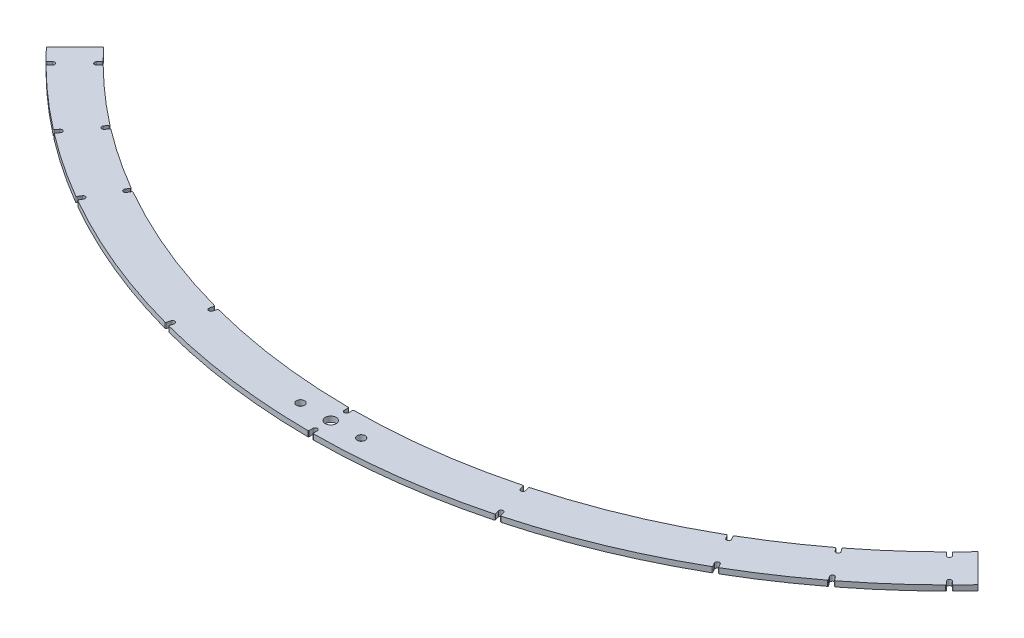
SolidWorks part; units mm, degrees
ref_plane "Piano frontale" through (0, 0, 0) normal (0, 0, 1) x (1, 0, 0)
ref_plane "Piano superiore" through (0, 0, 0) normal (0, 1, 0) x (1, 0, 0)
ref_plane "Piano destro" through (0, 0, 0) normal (1, 0, 0) x (0, 0, -1)
sketch "Schizzo1" plane through (0, 0, 0) normal (0, 1, 0) x (1, 0, 0)
  line L0 (1373.5999, 1371.11) -> (1394.8244, 1392.3345)
  line L2 (1385.3133, 1363.8729) -> (1383.2641, 1361.8237)
  line L3 (1387.576, 1361.6102) -> (1385.5268, 1359.561)
  line L4 (1403.9771, 1378.0112) -> (1406.0331, 1380.0673)
  line L5 (1401.7143, 1380.274) -> (1403.7704, 1382.33)
  line L6 (1431.4482, 1323.1353) -> (1429.684, 1320.8361)
  line L7 (1433.987, 1321.1873) -> (1432.2227, 1318.8881)
  line L8 (1448.1069, 1339.5888) -> (1449.877, 1341.8956)
  line L9 (1445.5682, 1341.5368) -> (1447.3383, 1343.8436)
  line L10 (1482.5058, 1288.768) -> (1481.0568, 1286.2582)
  line L11 (1485.2771, 1287.168) -> (1483.8281, 1284.6582)
  line L12 (1496.8744, 1307.2551) -> (1498.3282, 1309.7732)
  line L13 (1494.1031, 1308.8551) -> (1495.557, 1311.3732)
  line L14 (1595.8252, 1241.3775) -> (1595.0751, 1238.5782)
  line L15 (1598.9162, 1240.5493) -> (1598.1661, 1237.75)
  line L16 (1604.9194, 1262.9535) -> (1605.6719, 1265.7621)
  line L17 (1601.8284, 1263.7817) -> (1602.581, 1266.5903)
  line L18 (1717.5489, 1224.931) -> (1717.5489, 1222.0329)
  line L19 (1720.7489, 1224.931) -> (1720.7489, 1222.0329)
  line L20 (1720.7489, 1248.1255) -> (1720.7489, 1251.0332)
  line L21 (1717.5489, 1248.1255) -> (1717.5489, 1251.0332)
  line L22 (2043.4733, 1392.3345) -> (2064.6979, 1371.11)
  line L24 (2052.9844, 1363.8729) -> (2055.0337, 1361.8237)
  line L25 (2050.7217, 1361.6102) -> (2052.7709, 1359.561)
  line L26 (2034.3207, 1378.0112) -> (2032.2646, 1380.0673)
  line L27 (2036.5834, 1380.274) -> (2034.5274, 1382.33)
  line L28 (2006.8495, 1323.1353) -> (2008.6137, 1320.8361)
  line L29 (2004.3108, 1321.1873) -> (2006.075, 1318.8881)
  line L30 (1990.1908, 1339.5888) -> (1988.4207, 1341.8956)
  line L31 (1992.7295, 1341.5368) -> (1990.9594, 1343.8436)
  line L32 (1955.7919, 1288.768) -> (1957.2409, 1286.2582)
  line L33 (1953.0206, 1287.168) -> (1954.4697, 1284.6582)
  line L34 (1941.4233, 1307.2551) -> (1939.9695, 1309.7732)
  line L35 (1944.1946, 1308.8551) -> (1942.7408, 1311.3732)
  line L36 (1842.4725, 1241.3775) -> (1843.2226, 1238.5782)
  line L37 (1839.3816, 1240.5493) -> (1840.1316, 1237.75)
  line L38 (1833.3784, 1262.9535) -> (1832.6258, 1265.7621)
  line L39 (1836.4693, 1263.7817) -> (1835.7168, 1266.5903)
  circle A0 centre (1719.1489, 1236.5283) radius 4.05
  circle A1 centre (1696.6489, 1236.5283) radius 3
  arc A2 (1394.8244, 1392.3345) -> (1403.772, 1383.0354) centre (1719.1489, 1695.4458) ccw
  arc A3 (1406.7385, 1380.0689) -> (1447.2479, 1344.5432) centre (1719.1489, 1695.4458) ccw
  arc A4 (1450.5762, 1341.9893) -> (1495.376, 1312.055) centre (1719.1489, 1695.4458) ccw
  arc A5 (1499.0092, 1309.9574) -> (1602.2297, 1267.2021) centre (1719.1489, 1695.4458) ccw
  arc A6 (1606.282, 1266.1163) -> (1717.0512, 1251.5332) centre (1719.1489, 1695.4458) ccw
  arc A7 (1432.3168, 1318.1857) -> (1480.3719, 1286.0763) centre (1719.1489, 1695.4458) ccw
  arc A8 (1484.013, 1283.9741) -> (1594.4606, 1238.2252) centre (1719.1489, 1695.4458) ccw
  arc A9 (1598.5218, 1237.137) -> (1717.0466, 1221.5329) centre (1719.1489, 1695.4458) ccw
  arc A10 (1387.576, 1361.6102) -> (1385.3133, 1363.8729) centre (1386.4427, 1362.7396) ccw
  arc A11 (1385.5268, 1359.561) -> (1385.5284, 1358.8523) centre (1385.8804, 1359.2074) ccw
  arc A12 (1382.5554, 1361.8253) -> (1383.2641, 1361.8237) centre (1382.9105, 1362.1773) ccw
  arc A13 (1401.7143, 1380.274) -> (1403.9771, 1378.0112) centre (1402.8476, 1379.1445) ccw
  arc A14 (1403.7704, 1382.33) -> (1403.772, 1383.0354) centre (1403.4168, 1382.6836) ccw
  arc A15 (1406.7385, 1380.0689) -> (1406.0331, 1380.0673) centre (1406.3867, 1379.7137) ccw
  arc A16 (1433.987, 1321.1873) -> (1431.4482, 1323.1353) centre (1432.716, 1322.1591) ccw
  arc A17 (1432.2227, 1318.8881) -> (1432.3168, 1318.1857) centre (1432.6194, 1318.5837) ccw
  arc A18 (1428.9812, 1320.7452) -> (1429.684, 1320.8361) centre (1429.2873, 1321.1405) ccw
  arc A19 (1445.5682, 1341.5368) -> (1448.1069, 1339.5888) centre (1446.8392, 1340.5649) ccw
  arc A20 (1447.3383, 1343.8436) -> (1447.2479, 1344.5432) centre (1446.9416, 1344.148) ccw
  arc A21 (1450.5762, 1341.9893) -> (1449.877, 1341.8956) centre (1450.2737, 1341.5912) ccw
  arc A22 (1485.2771, 1287.168) -> (1482.5058, 1288.768) centre (1483.8901, 1287.9657) ccw
  arc A23 (1483.8281, 1284.6582) -> (1484.013, 1283.9741) centre (1484.2611, 1284.4082) ccw
  arc A24 (1480.3719, 1286.0763) -> (1481.0568, 1286.2582) centre (1480.6238, 1286.5082) ccw
  arc A25 (1494.1031, 1308.8551) -> (1496.8744, 1307.2551) centre (1495.4901, 1308.0574) ccw
  arc A26 (1495.557, 1311.3732) -> (1495.376, 1312.055) centre (1495.1239, 1311.6232) ccw
  arc A27 (1499.0092, 1309.9574) -> (1498.3282, 1309.7732) centre (1498.7612, 1309.5232) ccw
  arc A28 (1598.9162, 1240.5493) -> (1595.8252, 1241.3775) centre (1597.37, 1240.9608) ccw
  arc A29 (1598.1661, 1237.75) -> (1598.5218, 1237.137) centre (1598.649, 1237.6206) ccw
  arc A30 (1594.4606, 1238.2252) -> (1595.0751, 1238.5782) centre (1594.5922, 1238.7076) ccw
  arc A31 (1601.8284, 1263.7817) -> (1604.9194, 1262.9535) centre (1603.3746, 1263.3702) ccw
  arc A32 (1602.581, 1266.5903) -> (1602.2297, 1267.2021) centre (1602.098, 1266.7197) ccw
  arc A33 (1606.282, 1266.1163) -> (1605.6719, 1265.7621) centre (1606.1549, 1265.6327) ccw
  arc A34 (1720.7489, 1224.931) -> (1717.5489, 1224.931) centre (1719.1489, 1224.9283) ccw
  arc A35 (1720.7489, 1222.0329) -> (1721.2511, 1221.5329) centre (1721.2489, 1222.0329) ccw
  arc A36 (1717.0466, 1221.5329) -> (1717.5489, 1222.0329) centre (1717.0489, 1222.0329) ccw
  arc A37 (1717.5489, 1248.1255) -> (1720.7489, 1248.1255) centre (1719.1489, 1248.1283) ccw
  arc A38 (1717.5489, 1251.0332) -> (1717.0512, 1251.5332) centre (1717.0489, 1251.0332) ccw
  arc A39 (1721.2465, 1251.5332) -> (1720.7489, 1251.0332) centre (1721.2489, 1251.0332) ccw
  arc A40 (1373.5999, 1371.11) -> (1382.5554, 1361.8253) centre (1719.1489, 1695.4458) ccw
  arc A41 (1385.5284, 1358.8523) -> (1428.9812, 1320.7452) centre (1719.1489, 1695.4458) ccw
  circle A42 centre (1741.6489, 1236.5283) radius 3
  arc A43 (2034.5257, 1383.0354) -> (2043.4733, 1392.3345) centre (1719.1489, 1695.4458) ccw
  arc A44 (1991.0499, 1344.5432) -> (2031.5592, 1380.0689) centre (1719.1489, 1695.4458) ccw
  arc A45 (1942.9217, 1312.055) -> (1987.7215, 1341.9893) centre (1719.1489, 1695.4458) ccw
  arc A46 (1836.0681, 1267.2021) -> (1939.2885, 1309.9574) centre (1719.1489, 1695.4458) ccw
  arc A47 (1721.2465, 1251.5332) -> (1832.0157, 1266.1163) centre (1719.1489, 1695.4458) ccw
  arc A48 (1957.9259, 1286.0763) -> (2005.9809, 1318.1857) centre (1719.1489, 1695.4458) ccw
  arc A49 (1843.8371, 1238.2252) -> (1954.2847, 1283.9741) centre (1719.1489, 1695.4458) ccw
  arc A50 (1721.2511, 1221.5329) -> (1839.7759, 1237.137) centre (1719.1489, 1695.4458) ccw
  arc A51 (2052.9844, 1363.8729) -> (2050.7217, 1361.6102) centre (2051.855, 1362.7396) ccw
  arc A52 (2052.7694, 1358.8523) -> (2052.7709, 1359.561) centre (2052.4174, 1359.2074) ccw
  arc A53 (2055.0337, 1361.8237) -> (2055.7423, 1361.8253) centre (2055.3872, 1362.1773) ccw
  arc A54 (2034.3207, 1378.0112) -> (2036.5834, 1380.274) centre (2035.452, 1379.1426) ccw
  arc A55 (2034.5257, 1383.0354) -> (2034.5274, 1382.33) centre (2034.8809, 1382.6836) ccw
  arc A56 (2032.2646, 1380.0673) -> (2031.5592, 1380.0689) centre (2031.9111, 1379.7137) ccw
  arc A57 (2006.8495, 1323.1353) -> (2004.3108, 1321.1873) centre (2005.5818, 1322.1591) ccw
  arc A58 (2005.9809, 1318.1857) -> (2006.075, 1318.8881) centre (2005.6783, 1318.5837) ccw
  arc A59 (2008.6137, 1320.8361) -> (2009.3165, 1320.7452) centre (2009.0104, 1321.1405) ccw
  arc A60 (1990.1908, 1339.5888) -> (1992.7295, 1341.5368) centre (1991.4602, 1340.5628) ccw
  arc A61 (1991.0499, 1344.5432) -> (1990.9594, 1343.8436) centre (1991.3561, 1344.148) ccw
  arc A62 (1988.4207, 1341.8956) -> (1987.7215, 1341.9893) centre (1988.024, 1341.5912) ccw
  arc A63 (1955.7919, 1288.768) -> (1953.0206, 1287.168) centre (1954.4076, 1287.9657) ccw
  arc A64 (1954.2847, 1283.9741) -> (1954.4697, 1284.6582) centre (1954.0366, 1284.4082) ccw
  arc A65 (1957.2409, 1286.2582) -> (1957.9259, 1286.0763) centre (1957.6739, 1286.5082) ccw
  arc A66 (1941.4233, 1307.2551) -> (1944.1946, 1308.8551) centre (1942.8076, 1308.0574) ccw
  arc A67 (1942.9217, 1312.055) -> (1942.7408, 1311.3732) centre (1943.1738, 1311.6232) ccw
  arc A68 (1939.9695, 1309.7732) -> (1939.2885, 1309.9574) centre (1939.5365, 1309.5232) ccw
  arc A69 (1842.4725, 1241.3775) -> (1839.3816, 1240.5493) centre (1840.9278, 1240.9608) ccw
  arc A70 (1839.7759, 1237.137) -> (1840.1316, 1237.75) centre (1839.6487, 1237.6206) ccw
  arc A71 (1843.2226, 1238.5782) -> (1843.8371, 1238.2252) centre (1843.7056, 1238.7076) ccw
  arc A72 (1833.3784, 1262.9535) -> (1836.4693, 1263.7817) centre (1834.9232, 1263.3702) ccw
  arc A73 (1836.0681, 1267.2021) -> (1835.7168, 1266.5903) centre (1836.1997, 1266.7197) ccw
  arc A74 (1832.6258, 1265.7621) -> (1832.0157, 1266.1163) centre (1832.1429, 1265.6327) ccw
  arc A75 (2055.7423, 1361.8253) -> (2064.6979, 1371.11) centre (1719.1489, 1695.4458) ccw
  arc A76 (2009.3165, 1320.7452) -> (2052.7694, 1358.8523) centre (1719.1489, 1695.4458) ccw
extrude "Estrusione-Estrusione1" add sketch "Schizzo1" along normal blind 4
move or copy body "Corpo-Sposta/copia1" [suppressed] bodies to move or copy 101
